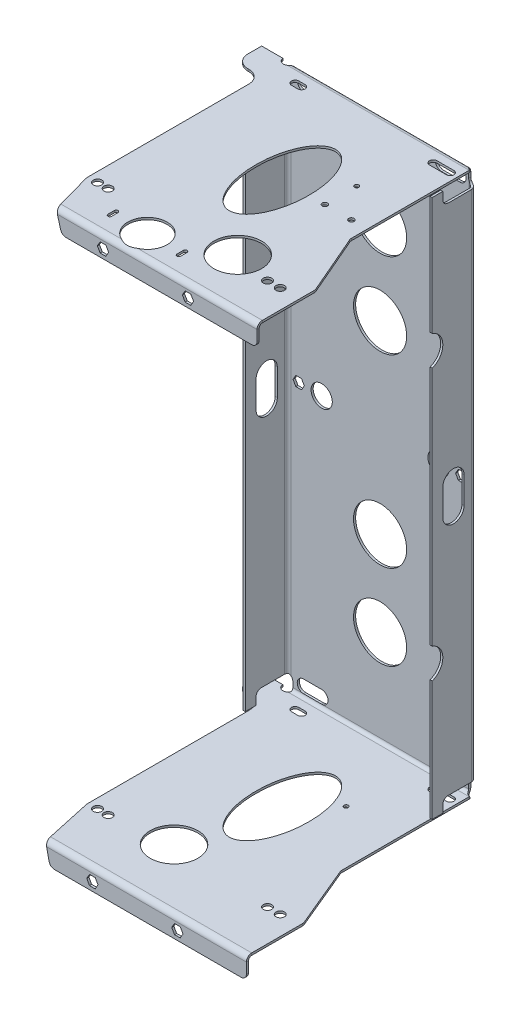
SolidWorks part; units mm, degrees
ref_plane "Plan1" through (0, 0, 0) normal (0, 0, 1) x (1, 0, 0)
ref_plane "Plan2" through (0, 0, 0) normal (0, 1, 0) x (1, 0, 0)
ref_plane "Plan3" through (0, 0, 0) normal (1, 0, 0) x (0, 0, -1)
sketch "Esquisse1" plane through (0, 0, 0) normal (0, 0, 1) x (1, 0, 0)
  line L0 (110, -11.6554) -> (120, -11.6554)
  line L1 (-80.69, -769.7197) -> (-93.7937, -709.5711)
  line L2 (89.3652, 233.3446) -> (-75, 233.3446)
  line L3 (80, 103.3446) -> (80, 6.3637)
  line L4 (-134, -11.6554) -> (-124, -11.6554)
  line L5 (-73, -530.1554) -> (-67, -530.1554)
  line L6 (-124, -518.6554) -> (-134, -518.6554)
  line L7 (80, -522.1554) -> (80, -642.6554)
  line L8 (84.9855, -773.6554) -> (-75.8046, -773.6554)
  line L9 (-89, -519.1554) -> (-89, -511.6554)
  line L10 (120, -518.6554) -> (110, -518.6554)
  line L11 (120, -11.6554) -> (120, -122.5132)
  line L12 (80, -8.1554) -> (80, 6.3637)
  line L13 (80.4092, 105.3257) -> (104.5908, 161.3636)
  line L14 (105, 163.3446) -> (105, 228.3446)
  line L15 (100, 233.3446) -> (89.3652, 233.3446)
  line L16 (80.3846, -644.5785) -> (104.6154, -702.7323)
  line L17 (105, -704.6554) -> (105, -768.6554)
  line L18 (100, -773.6554) -> (84.9855, -773.6554)
  line L19 (-79.818, 229.6815) -> (-93.6723, 179.751)
  line L20 (-107, -544.1554) -> (-106, -544.1554)
  line L21 (-124, -511.6554) -> (-124, -518.6554)
  line L22 (-107, 13.8446) -> (-106, 13.8446)
  line L23 (-134, -11.6554) -> (-134, -151.3156)
  line L24 (-73, 6.8446) -> (-67, 6.8446)
  line L25 (-73, -537.1554) -> (-67, -537.1554)
  line L26 (-73, -0.1554) -> (-67, -0.1554)
  line L27 (-54.25, 198.3446) -> (-54.25, 192.3446)
  line L28 (57, 6.8446) -> (73, 6.8446)
  line L29 (-134, -378.9951) -> (-134, -518.6554)
  line L30 (57, -0.1554) -> (73, -0.1554)
  line L31 (-37.3442, 220.7446) -> (-34.6884, 225.3446)
  line L32 (-34.6884, 225.3446) -> (-37.3442, 229.9446)
  line L33 (-37.3442, 229.9446) -> (-42.6558, 229.9446)
  line L34 (-42.6558, 229.9446) -> (-45.3116, 225.3446)
  line L35 (-45.3116, 225.3446) -> (-42.6558, 220.7446)
  line L36 (-42.6558, 220.7446) -> (-37.3442, 220.7446)
  line L37 (42.6558, 220.7446) -> (45.3116, 225.3446)
  line L38 (45.3116, 225.3446) -> (42.6558, 229.9446)
  line L39 (42.6558, 229.9446) -> (37.3442, 229.9446)
  line L40 (37.3442, 229.9446) -> (34.6884, 225.3446)
  line L41 (34.6884, 225.3446) -> (37.3442, 220.7446)
  line L42 (37.3442, 220.7446) -> (42.6558, 220.7446)
  line L43 (-37.3442, -770.2554) -> (-34.6884, -765.6554)
  line L44 (-34.6884, -765.6554) -> (-37.3442, -761.0554)
  line L45 (-37.3442, -761.0554) -> (-42.6558, -761.0554)
  line L46 (-42.6558, -761.0554) -> (-45.3116, -765.6554)
  line L47 (-45.3116, -765.6554) -> (-42.6558, -770.2554)
  line L48 (-42.6558, -770.2554) -> (-37.3442, -770.2554)
  line L49 (42.6558, -770.2554) -> (45.3116, -765.6554)
  line L50 (45.3116, -765.6554) -> (42.6558, -761.0554)
  line L51 (42.6558, -761.0554) -> (37.3442, -761.0554)
  line L52 (37.3442, -761.0554) -> (34.6884, -765.6554)
  line L53 (34.6884, -765.6554) -> (37.3442, -770.2554)
  line L54 (37.3442, -770.2554) -> (42.6558, -770.2554)
  line L55 (-50.75, 198.3446) -> (-50.75, 192.3446)
  line L56 (57, -530.1554) -> (73, -530.1554)
  line L57 (10.75, 198.3446) -> (10.75, 192.3446)
  line L58 (-134, -151.3156) -> (-134, -378.9951)
  line L59 (14.25, 198.3446) -> (14.25, 192.3446)
  line L60 (57, -537.1554) -> (73, -537.1554)
  line L61 (-89, -11.6554) -> (-89, -18.6554)
  line L62 (120, -405.7975) -> (120, -518.6554)
  line L63 (-94, -23.6554) -> (-119, -23.6554)
  line L64 (120, -150.7975) -> (120, -377.5132)
  line L65 (-98.9749, -11.1554) -> (-119, -11.1554)
  line L66 (66.8442, -260.5554) -> (64.1884, -265.1554)
  line L67 (64.1884, -265.1554) -> (66.8442, -269.7554)
  line L68 (66.8442, -269.7554) -> (72.1558, -269.7554)
  line L69 (72.1558, -269.7554) -> (74.8116, -265.1554)
  line L70 (74.8116, -265.1554) -> (72.1558, -260.5554)
  line L71 (72.1558, -260.5554) -> (66.8442, -260.5554)
  line L72 (-88.8116, -265.1554) -> (-86.1558, -269.7554)
  line L73 (-86.1558, -269.7554) -> (-80.8442, -269.7554)
  line L74 (-80.8442, -269.7554) -> (-78.1884, -265.1554)
  line L75 (-78.1884, -265.1554) -> (-80.8442, -260.5554)
  line L76 (-80.8442, -260.5554) -> (-86.1558, -260.5554)
  line L77 (-86.1558, -260.5554) -> (-88.8116, -265.1554)
  line L78 (-119, 1.8446) -> (-119, -11.1554)
  line L79 (-94, -506.6554) -> (-119, -506.6554)
  line L80 (-124, -18.6554) -> (-124, -11.6554)
  line L81 (-119, -519.1554) -> (-99, -519.1554)
  line L82 (-119, -519.1554) -> (-119, -532.1554)
  line L83 (76.5, -11.6554) -> (76.5, -18.6554)
  line L84 (81.5, -23.6554) -> (105, -23.6554)
  line L85 (110, -18.6554) -> (110, -11.6554)
  line L86 (76.5, -518.6554) -> (76.5, -511.6554)
  line L87 (81.5, -506.6554) -> (105, -506.6554)
  line L88 (110, -511.6554) -> (110, -518.6554)
  line L89 (-94, 25.8446) -> (-94, 177.3446)
  line L90 (-94, -556.1554) -> (-94, -707.6554)
  arc A0 (-79.818, 229.6815) -> (-75, 233.3446) centre (-75, 228.3446) cw
  arc A1 (80.3846, -644.5785) -> (80, -642.6554) centre (85, -642.6554) cw
  circle A2 centre (-40, -765.6554) radius 4.6 construction
  circle A3 centre (40, -765.6554) radius 4.6 construction
  arc A4 (105, -704.6554) -> (104.6154, -702.7323) centre (100, -704.6554) ccw
  arc A5 (-75.8046, -773.6554) -> (-80.69, -769.7197) centre (-75.8046, -768.6554) cw
  arc A6 (-89, -11.6554) -> (-98.9749, -11.1554) centre (-94, -11.6554) ccw
  arc A7 (100, -773.6554) -> (105, -768.6554) centre (100, -768.6554) ccw
  arc A8 (105, 228.3446) -> (100, 233.3446) centre (100, 228.3446) ccw
  arc A9 (76.5, -18.6554) -> (81.5, -23.6554) centre (81.5, -18.6554) ccw
  arc A10 (76.5, -518.6554) -> (80, -522.1554) centre (80, -518.6554) ccw
  arc A11 (-99, -519.1554) -> (-89, -519.1554) centre (-94, -519.1554) ccw
  circle A12 centre (-85, -707.6554) radius 4
  arc A13 (-124, -511.6554) -> (-119, -506.6554) centre (-119, -511.6554) cw
  circle A14 centre (-40, 225.3446) radius 4.6 construction
  circle A15 centre (40, 225.3446) radius 4.6 construction
  arc A16 (104.5908, 161.3636) -> (105, 163.3446) centre (100, 163.3446) ccw
  arc A17 (80, 103.3446) -> (80.4092, 105.3257) centre (85, 103.3446) cw
  arc A18 (-94, -707.6554) -> (-93.7937, -709.5711) centre (-85, -707.6554) ccw
  arc A19 (-119, -23.6554) -> (-124, -18.6554) centre (-119, -18.6554) cw
  circle A20 centre (40, 58.3446) radius 2
  circle A21 centre (65, 88.3446) radius 2.5
  circle A22 centre (75, 177.3446) radius 4
  circle A23 centre (40, 170.3446) radius 22.5
  circle A24 centre (-20, 195.3446) radius 18.5
  circle A25 centre (-20, -700.6554) radius 22.5
  circle A26 centre (30, -588.6554) radius 2
  arc A27 (-73, 6.8446) -> (-73, -0.1554) centre (-73, 3.3446) ccw
  arc A28 (-67, 6.8446) -> (-67, -0.1554) centre (-67, 3.3446) cw
  arc A29 (57, 6.8446) -> (57, -0.1554) centre (57, 3.3446) ccw
  arc A30 (73, 6.8446) -> (73, -0.1554) centre (73, 3.3446) cw
  circle A31 centre (40, 88.3446) radius 2.5
  arc A32 (14.25, 198.3446) -> (10.75, 198.3446) centre (12.5, 198.3446) ccw
  arc A33 (-50.75, 198.3446) -> (-54.25, 198.3446) centre (-52.5, 198.3446) ccw
  arc A34 (-50.75, 192.3446) -> (-54.25, 192.3446) centre (-52.5, 192.3446) cw
  arc A35 (14.25, 192.3446) -> (10.75, 192.3446) centre (12.5, 192.3446) cw
  circle A36 centre (87, 177.3446) radius 4
  circle A37 centre (87, -707.6554) radius 4
  arc A38 (120, -122.5132) -> (120, -150.7975) centre (125, -136.6554) ccw
  arc A39 (120, -377.5132) -> (120, -405.7975) centre (125, -391.6554) ccw
  circle A40 centre (-85, 177.3446) radius 4
  arc A41 (-93.6723, 179.751) -> (-94, 177.3446) centre (-85, 177.3446) ccw
  arc A42 (-73, -530.1554) -> (-73, -537.1554) centre (-73, -533.6554) ccw
  arc A43 (-67, -530.1554) -> (-67, -537.1554) centre (-67, -533.6554) cw
  arc A44 (57, -530.1554) -> (57, -537.1554) centre (57, -533.6554) ccw
  arc A45 (73, -530.1554) -> (73, -537.1554) centre (73, -533.6554) cw
  arc A46 (-94, -23.6554) -> (-89, -18.6554) centre (-94, -18.6554) ccw
  arc A47 (-89, -511.6554) -> (-94, -506.6554) centre (-94, -511.6554) ccw
  circle A48 centre (69.5, -265.1554) radius 4.6 construction
  circle A49 centre (-83.5, -265.1554) radius 4.6 construction
  arc A50 (80, -8.1554) -> (76.5, -11.6554) centre (80, -11.6554) ccw
  circle A51 centre (75, -707.6554) radius 4
  arc A52 (110, -18.6554) -> (105, -23.6554) centre (105, -18.6554) cw
  arc A53 (76.5, -511.6554) -> (81.5, -506.6554) centre (81.5, -511.6554) cw
  arc A54 (110, -511.6554) -> (105, -506.6554) centre (105, -511.6554) ccw
  arc A55 (-119, 1.8446) -> (-107, 13.8446) centre (-107, 1.8446) cw
  arc A56 (-106, 13.8446) -> (-94, 25.8446) centre (-106, 25.8446) ccw
  arc A57 (-107, -544.1554) -> (-119, -532.1554) centre (-107, -532.1554) cw
  arc A58 (-94, -556.1554) -> (-106, -544.1554) centre (-106, -556.1554) ccw
  circle A59 centre (-75, 177.3446) radius 4
  circle A60 centre (-75, -707.6554) radius 4
  ellipse E0 centre (0, 88.3446) end of major axis (0, 138.3446) minor radius 25
  ellipse E1 centre (0, -618.6554) end of major axis (0, -568.6554) minor radius 25
  point P29 (80, -643.6554)
  point P31 (80, 233.3446)
  point P34 (-80, 233.3446)
  point P35 (-80, 233.3446)
  point P37 (105, -703.6554)
  point P45 (80, -773.6554)
  point P219 (-119, 13.8446)
  point P225 (-119, -544.1554)
  dimension "D5" = 40
  dimension "D13" = 255
  dimension "D17" = 9.2
  dimension "D18" = 70
  dimension "D20" = 60
  dimension "D19" = 245
  dimension "D22" = 5
  dimension "D32" = 199
  dimension "D33" = 5
  dimension "D34" = 7
  dimension "D36" = 10
  dimension "D37" = 5
  dimension "D7" = 5
  dimension "D40" = 5
  dimension "D31" = 10
  dimension "D42" = 15
  dimension "D46" = 0.5
  dimension "D21" = 189
  dimension "D48" = 4
  dimension "D51" = 37
  dimension "D53" = 45
  dimension "D63" = 5
  dimension "D66" = 1.75
  dimension "D75" = 4
  dimension "D78" = 16
  dimension "D80" = 45
  dimension "D82" = 5
  dimension "D85" = 25
  dimension "D94" = 255
  dimension "D106" = 9
  dimension "D84" = 5
  dimension "D88" = 30
  dimension "D86" = 60
  dimension "D104" = 25
  dimension "D109" = 25
  dimension "D97" = 30
  dimension "D107" = 12
  dimension "D111" = 30
  dimension "D64" = 40
  dimension "D110" = 0.5
  dimension "D14" = 160
  dimension "D24" = 189
  dimension "D83" = 12
  dimension "D87" = 5
  dimension "D12" = 94
  dimension "D112" = 25
  dimension "D81" = 12
  dimension "D52" = 7
  dimension "D114" = 30
  dimension "D115" = 5
  dimension "D116" = 30
  dimension "D117" = 12
  dimension "D118" = 12
  dimension "D61" = 146
  dimension "D91" = 146
  dimension "D121" = 12
  dimension "D123" = 10
  dimension "D124" = 10
  dimension "D126" = 18
  dimension "D127" = 18
  dimension "D9" = 507
  dimension "D10" = 80
  dimension "D15" = 8
  dimension "D16" = 8
  dimension "D23" = 40
  dimension "D25" = 25
  dimension "D26" = 80
  dimension "D27" = 80
  dimension "D28" = 9.2
  dimension "D29" = 9.2
  dimension "D30" = 9.2
  dimension "D35" = 245
  dimension "D38" = 70
  dimension "D39" = 60
  dimension "D41" = 175.8046
  dimension "D43" = 9
  dimension "D44" = 15
  dimension "D45" = 160
  dimension "D47" = 25
  dimension "D49" = 70
  dimension "D50" = 30
  dimension "D54" = 25
  dimension "D55" = 80
  dimension "D56" = 50
  dimension "D57" = 100
  dimension "D58" = 100
  dimension "D59" = 16
  dimension "D60" = 7
  dimension "D62" = 7
  dimension "D65" = 65
  dimension "D67" = 6
  dimension "D68" = 32.5
  dimension "D69" = 3
  dimension "D70" = 40
  dimension "D71" = 50
  dimension "D72" = 100
  dimension "D73" = 80
  dimension "D74" = 100
  dimension "D76" = 50
  dimension "D77" = 70
  dimension "D79" = 182
  dimension "D89" = 7
  dimension "D90" = 7
  dimension "D92" = 15
  dimension "D93" = 15
  dimension "D95" = 127
  dimension "D96" = 5
  dimension "D98" = 9.2
  dimension "D99" = 9.2
  dimension "D100" = 253.5
  dimension "D101" = 254
  dimension "D102" = 50.5
  dimension "D103" = 153
  dimension "D105" = 12
  dimension "D108" = 182
  dimension "D113" = 25
  dimension "D119" = 6
  dimension "D120" = 6
  dimension "D122" = 12
  dimension "D125" = 199
extrude "Base-Extrusion" add sketch "Esquisse1" along normal blind 2
sheet metal parameters "Tôlerie 1" parameters "D1"=3
flatten bends "Dépliage 1" parameters "D1"=0
sketch "Esquisse-Angle1" plane through (0, 0, 2) normal (0, 0, 1) x (1, 0, 0)
process bends "Pliage 1" parameters "D1"=3
sketch "Esquisse-Plate1" plane through (0, 0, 2) normal (0, 0, 1) x (1, 0, 0)
  line L0 (-96.9574, -10.6554) -> (84.385, -10.6554) construction
  line L1 (120, -11.6554) -> (120, -122.5132) construction
  line L2 (100, 233.3446) -> (-75, 233.3446) construction
  line L4 (-134, -11.6554) -> (-124, -11.6554) construction
  line L5 (-124, -518.6554) -> (-134, -518.6554) construction
  line L6 (100, -773.6554) -> (-75.8046, -773.6554) construction
  line L7 (-99, 215.3446) -> (119.8842, 215.3446) construction
  line L9 (-94, -519.6554) -> (84.385, -519.6554) construction
  line L11 (-99, 223.673) -> (-99, 199.2084) construction
  line L12 (80.1, -15.3305) -> (80.1, -519.6554) construction
  line L13 (80, -8.1554) -> (80, 103.3446) construction
  line L17 (-99, -755.6554) -> (109.8347, -755.6554) construction
  line L18 (-94, -13.2891) -> (-94, -518.2402) construction
  line L22 (-99, -773.327) -> (-99, -743.327) construction
  point P6 (-91.4058, -265.1554)
  dimension "D6" = 174.1
  dimension "D1" = 18
  dimension "D2" = 18
  dimension "D3" = 1
  dimension "D4" = 1
  dimension "D5" = 0.1
  dimension "D7" = 39.9
bend "Pli défini à plat4" bend radius 3 bend angle 90 parameters "D5"=1
bend "Pli défini à plat12" bend radius 3 bend angle 90 parameters "D5"=2
bend "Pli défini à plat13" bend angle 90 parameters "D1"=0, "D5"=3
bend "Pli défini à plat14" bend angle 90 parameters "D1"=0, "D5"=4
bend "Pli défini à plat16" bend angle 90 parameters "D1"=0, "D5"=5
bend "Pli défini à plat17" bend angle 90 parameters "D1"=0, "D5"=6
sketch "Esquisse4" plane through (0, -495.5314, 2) normal (0, 0, -1) x (-1, 0, 0)
  line L0 (84.6678, 486.7344) -> (27.6187, 486.7344) construction
  line L1 (95.8584, 483.876) -> (95.8584, -23.124) construction
  line L2 (-80.4092, 484.7344) -> (-104.5908, 484.7344) construction
  line L3 (-81.9584, 344.7339) -> (-81.9584, 118.0181) construction
  line L4 (61.8584, 481.3276) -> (78.8584, 481.3276)
  line L5 (-81.9584, 471.876) -> (-81.9584, -11.124) construction
  line L6 (61.8584, 469.7344) -> (78.8584, 469.7344)
  line L8 (-68.1416, 481.7344) -> (-51.1416, 481.7344)
  line L10 (-68.1416, 469.7344) -> (-51.1416, 469.7344)
  line L11 (-68.1416, -8.9824) -> (-51.1416, -8.9824)
  line L12 (-80.3846, -23.9824) -> (-104.6154, -23.9824) construction
  line L13 (-68.1416, -20.9824) -> (-51.1416, -20.9824)
  line L15 (61.8584, -8.9824) -> (78.8584, -8.9824)
  line L17 (61.8584, -20.9824) -> (78.8584, -20.9824)
  circle A0 centre (6.8584, 399.1344) radius 25
  circle A1 centre (6.8584, 319.1344) radius 25
  circle A2 centre (6.8584, 145.1344) radius 25
  circle A3 centre (6.8584, 65.1344) radius 25
  arc A4 (78.8584, 481.3276) -> (78.8584, 469.7344) centre (78.8584, 475.531) cw
  arc A5 (61.8584, 469.7344) -> (61.8584, 481.3276) centre (61.8584, 475.531) cw
  arc A6 (-51.1416, 481.7344) -> (-51.1416, 469.7344) centre (-51.1416, 475.7344) cw
  arc A7 (-68.1416, 481.7344) -> (-68.1416, 469.7344) centre (-68.1416, 475.7344) ccw
  arc A8 (78.8584, -8.9824) -> (78.8584, -20.9824) centre (78.8584, -14.9824) cw
  arc A9 (61.8584, -20.9824) -> (61.8584, -8.9824) centre (61.8584, -14.9824) cw
  arc A10 (-51.1416, -8.9824) -> (-51.1416, -20.9824) centre (-51.1416, -14.9824) cw
  arc A11 (-68.1416, -8.9824) -> (-68.1416, -20.9824) centre (-68.1416, -14.9824) ccw
  circle A12 centre (-48.1416, 230.376) radius 10
  circle A13 centre (61.8584, 230.376) radius 10
  point P10 (95.8584, 148.0961)
  point P11 (-81.9584, 151.3178)
  dimension "D1" = 50
  dimension "D2" = 80
  dimension "D3" = 80
  dimension "D4" = 174
  dimension "D5" = 87.6
  dimension "D7" = 89
  dimension "D17" = 20
  dimension "D18" = 110
  dimension "D19" = 55
  dimension "D12" = 17
  dimension "D6" = 177.8168
  dimension "D8" = 17
  dimension "D9" = 17
  dimension "D10" = 12
  dimension "D11" = 113
  dimension "D13" = 3
  dimension "D14" = 12
  dimension "D15" = 3
  dimension "D16" = 113
  dimension "D20" = 88.8168
extrude "Enlèv. mat.-Extru.8" cut sketch "Esquisse4" along normal blind 5
sketch "Esquisse5" plane through (81.9584, 0, 0) normal (1, 0, 0) x (0, 0, -1)
  line L0 (0, -265.1554) -> (-2, -265.1554) construction
  line L1 (-31.7584, -252.6554) -> (-31.7584, -277.6554)
  line L2 (-11.7584, -252.6554) -> (-11.7584, -277.6554)
  line L3 (-41.7584, -150.7975) -> (-41.7584, -377.5132) construction
  arc A0 (-11.7584, -252.6554) -> (-31.7584, -252.6554) centre (-21.7584, -252.6554) ccw
  arc A1 (-31.7584, -277.6554) -> (-11.7584, -277.6554) centre (-21.7584, -277.6554) ccw
  dimension "D1" = 10
  dimension "D4" = 12.5
  dimension "D2" = 25
  dimension "D3" = 10
extrude "Enlèv. mat.-Extru.9" cut sketch "Esquisse5" against normal through all
